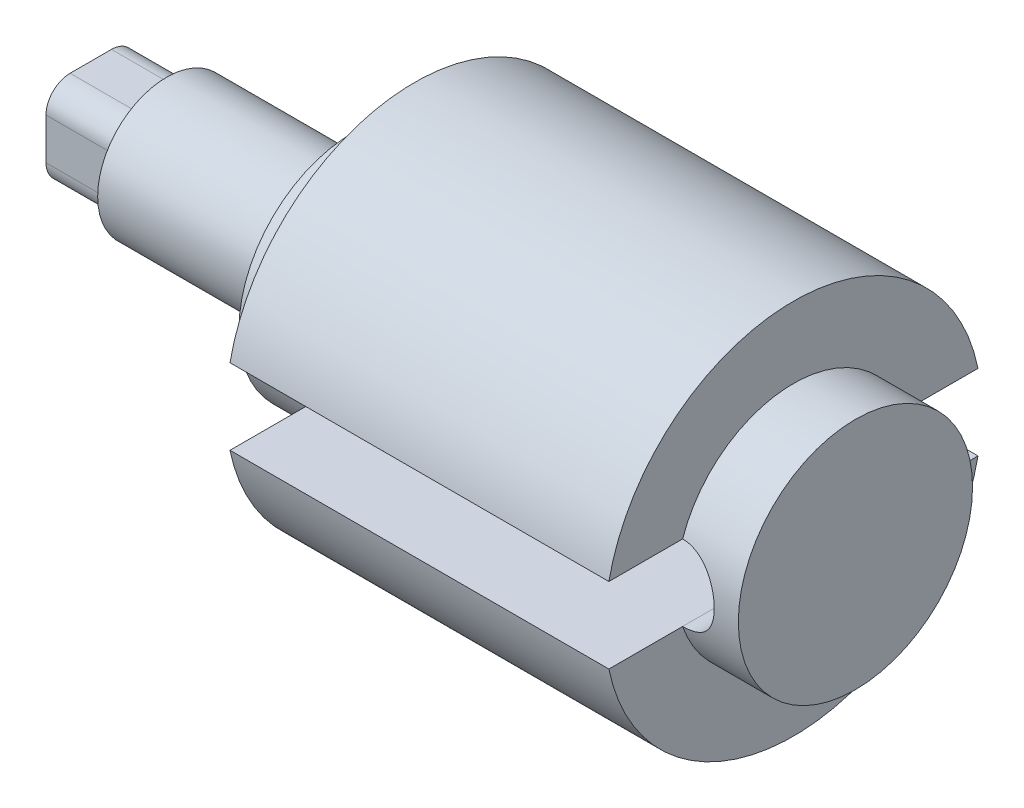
SolidWorks part; units mm, degrees
ref_plane "Plan de face" through (0, 0, 0) normal (0, 0, 1) x (1, 0, 0)
ref_plane "Plan de dessus" through (0, 0, 0) normal (0, 1, 0) x (1, 0, 0)
ref_plane "Plan de droite" through (0, 0, 0) normal (1, 0, 0) x (0, 0, -1)
sketch "Esquisse1" plane through (0, 0, 0) normal (0, 0, 1) x (1, 0, 0)
  line L0 (0, 0) -> (111, 0) construction
  line L1 (0, 0) -> (0, 10)
  line L2 (0, 10) -> (38, 10)
  line L3 (38, 10) -> (38, 16.5)
  line L4 (38, 16.5) -> (47, 16.5)
  line L5 (47, 16.5) -> (47, 27.35)
  line L6 (47, 27.35) -> (102, 27.35)
  line L7 (102, 27.35) -> (102, 17)
  line L8 (102, 17) -> (111, 17)
  line L9 (111, 17) -> (111, 0)
  line L10 (0, 0) -> (111, 0)
  dimension "D1" = 9
  dimension "D2" = 55
  dimension "D3" = 9
  dimension "D4" = 38
  dimension "D5" = 20
  dimension "D6" = 33
  dimension "D7" = 34
  dimension "D8" = 54.7
revolve "Révolution1" add sketch "Esquisse1" angle 360 about L0
sketch "Esquisse2" plane through (0, 0, 0) normal (0, 0, 1) x (1, 0, 0)
  line L0 (47, 27.35) -> (47, -27.35) construction
  line L1 (47, 5.5) -> (102, 5.5)
  line L3 (47, -5.5) -> (102, -5.5)
  line L5 (102, -27.35) -> (102, 27.35) construction
  arc A0 (102, 5.5) -> (102, -5.5) centre (102, 0) cw
  arc A1 (47, -5.5) -> (47, 5.5) centre (47, 0) cw
  dimension "D1" = 5.5
  dimension "D2" = 11
extrude "Enlèv. mat.-Extru.1" cut sketch "Esquisse2" against normal through all and the other way through all
sketch "Esquisse3" plane through (0, 0, 0) normal (-1, 0, 0) x (0, 0, 1)
  line L1 (-3, 6.5) -> (3, 6.5)
  line L2 (-6.5, 3) -> (-6.5, -3)
  line L3 (-3, -6.5) -> (3, -6.5)
  line L4 (6.5, 3) -> (6.5, -3)
  arc A0 (-3, 6.5) -> (-6.5, 3) centre (-3, 3) ccw
  arc A1 (3, 6.5) -> (6.5, 3) centre (3, 3) cw
  arc A2 (3, -6.5) -> (6.5, -3) centre (3, -3) ccw
  arc A3 (-6.5, -3) -> (-3, -6.5) centre (-3, -3) ccw
  point P7 (-6.5, 6.5)
  point P10 (6.5, 6.5)
  point P13 (6.5, -6.5)
  dimension "D5" = 3.5
  dimension "D1" = 6.5
  dimension "D2" = 13
  dimension "D3" = 6.5
  dimension "D4" = 13
extrude "Enlèv. mat.-Extru.2" cut sketch "Esquisse3" against normal blind 11 flip side to cut
hole_wizard "Trou taraudé M61" positions "Esquisse5" profile "Esquisse4" tap size "M6" standard "ISO"
sketch "Esquisse5" plane through (0, 0, 0) normal (-1, 0, 0) x (0, 0, 1)
  point P0 (0, 0)
sketch "Esquisse4" plane through (0, 0, 0) normal (0, 1, 0) x (0, 0, 1)
  line L0 (0, 0) -> (0, 18.5022)
  line L1 (0, 18.5022) -> (2.5, 17)
  line L2 (2.5, 17) -> (2.5, 0)
  line L5 (2.5, 0) -> (0, 0)
  line L10 (0, 18.5022) -> (-2.5, 17) construction
  line L11 (0, -6.35) -> (0, 107.95) construction
  dimension "Diamètre du trou pour taraudage" = 5
  dimension "Profondeur du trou pour taraudage" = 17
  dimension "Angle de pointe" = 118
